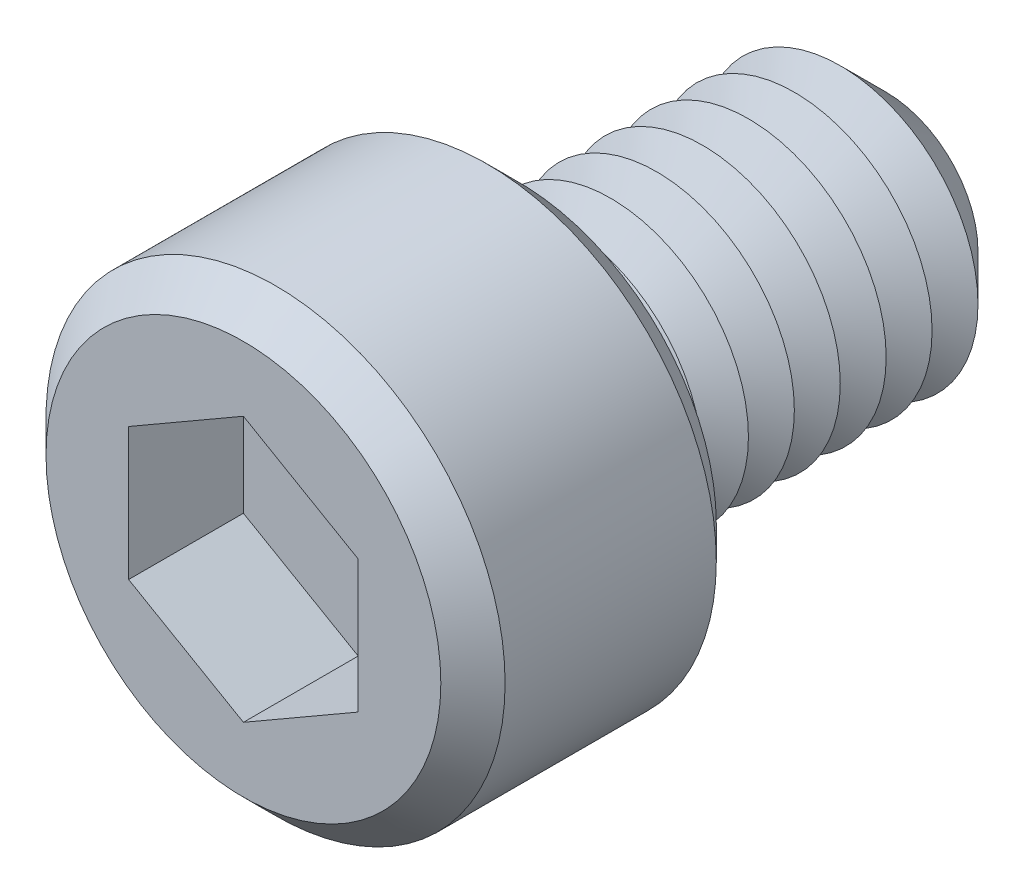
SolidWorks part; units mm, degrees
ref_plane "Front Plane" through (0, 0, 0) normal (0, 0, 1) x (1, 0, 0)
ref_plane "Top Plane" through (0, 0, 0) normal (0, 1, 0) x (1, 0, 0)
ref_plane "Right Plane" through (0, 0, 0) normal (1, 0, 0) x (0, 0, -1)
sketch "Sketch1" plane through (0, 0, 0) normal (0, 0, 1) x (1, 0, 0)
  circle A0 centre (0, 0) radius 5
  dimension "D1" = 10
extrude "Boss-Extrude1" add sketch "Sketch1" along normal blind 6
sketch "Sketch2" plane through (0, 0, 0) normal (0, 0, -1) x (-1, 0, 0)
  circle A0 centre (0, 0) radius 3
  dimension "D1" = 6
extrude "Boss-Extrude2" add sketch "Sketch2" along normal blind 8
chamfer "Chamfer1" distance 1 angle 45 1 edges at (-3, 0, -8)
sketch "Sketch3" plane through (0, 0, 0) normal (1, 0, 0) x (0, 0, -1)
  line L0 (-2.5121, 0) -> (4.5776, 0) construction
sketch "Sketch4" plane through (0, 0, 0) normal (1, 0, 0) x (0, 0, -1)
  line L0 (0, 3) -> (0.5, 2.134)
  line L1 (0.5, 2.134) -> (1, 3)
  line L2 (7, 3) -> (0, 3) construction
  line L3 (1, 3) -> (0, 3)
  dimension "D1" = 1
revolve "Cut-Revolve1" cut sketch "Sketch4" angle 360 about L0
pattern_linear "LPattern1" count 7 spacing 1 along (0, 0, -1) of "Cut-Revolve1"
sketch "Sketch5" plane through (0, 0, 6) normal (0, 0, 1) x (1, 0, 0)
  line L1 (0, 2.8868) -> (-2.5, 1.4434)
  line L2 (-2.5, 1.4434) -> (-2.5, -1.4434)
  line L3 (-2.5, -1.4434) -> (0, -2.8868)
  line L4 (0, -2.8868) -> (2.5, -1.4434)
  line L5 (2.5, -1.4434) -> (2.5, 1.4434)
  line L6 (2.5, 1.4434) -> (0, 2.8868)
  circle A0 centre (0, 0) radius 2.5 construction
  dimension "D1" = 5
extrude "Cut-Extrude1" cut sketch "Sketch5" against normal blind 2.5
sketch "Sketch6" plane through (0, 0, 3.5) normal (0, 0, 1) x (1, 0, 0)
  circle A0 centre (0, 0) radius 0.8
  dimension "D1" = 1.6
extrude "Cut-Extrude2" cut sketch "Sketch6" against normal up to surface (11.5 mm away)
chamfer "Chamfer2" distance 0.7 angle 45 2 edges at (5, 0, 0) (5, 0, 6)
